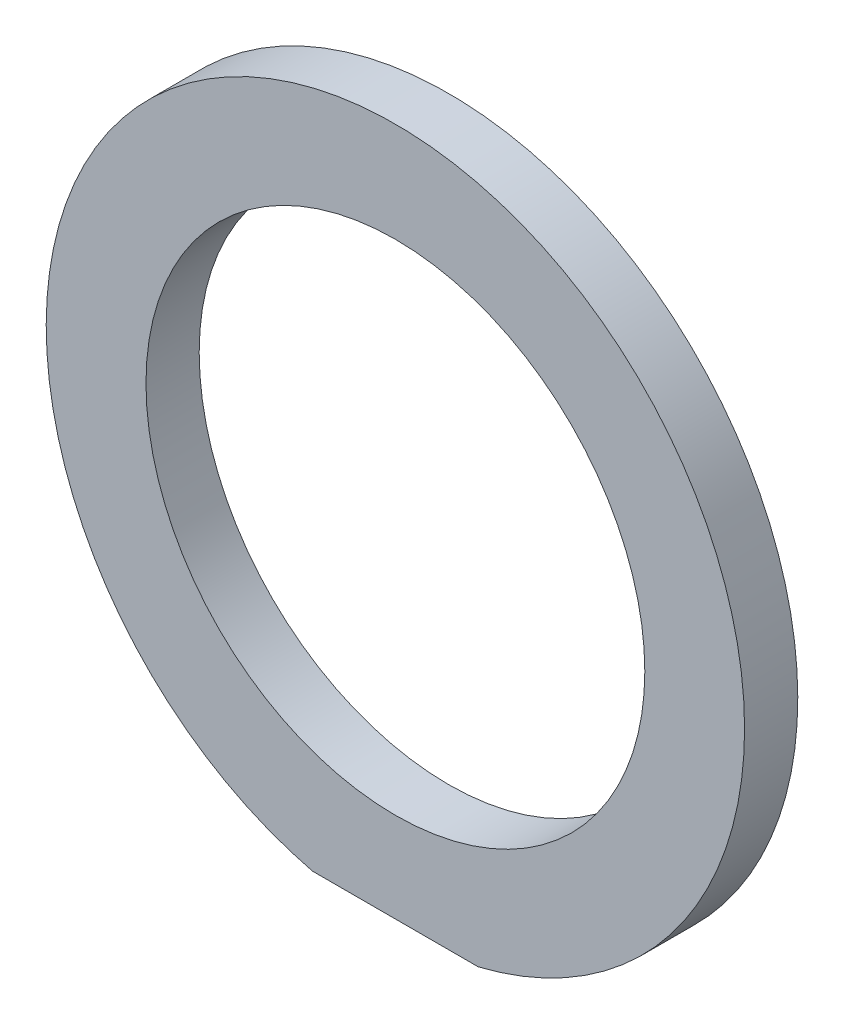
SolidWorks part; units mm, degrees
ref_plane "Спереди" through (0, 0, 0) normal (0, 0, 1) x (1, 0, 0)
ref_plane "Сверху" through (0, 0, 0) normal (0, 1, 0) x (1, 0, 0)
ref_plane "Справа" through (0, 0, 0) normal (1, 0, 0) x (0, 0, -1)
sketch "Эскиз1" plane through (0, 0, 0) normal (0, 0, 1) x (1, 0, 0)
  line L0 (-12.4599, -51) -> (12.4599, -51)
  circle A0 centre (0, 0) radius 37.5
  arc A1 (12.4599, -51) -> (-12.4599, -51) centre (0, 0) ccw
  dimension "D1" = 75
  dimension "D2" = 105
extrude "Бобышка-Вытянуть1" add sketch "Эскиз1" along normal blind 8
